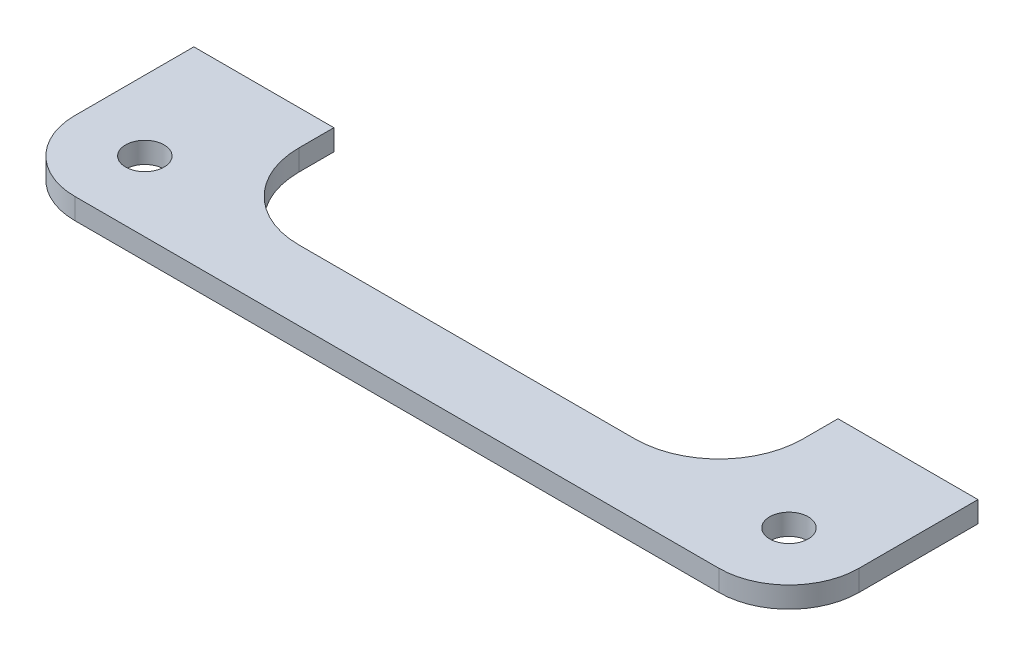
SolidWorks part; units mm, degrees
ref_plane "Front Plane" through (0, 0, 0) normal (0, 0, 1) x (1, 0, 0)
ref_plane "Top Plane" through (0, 0, 0) normal (0, 1, 0) x (1, 0, 0)
ref_plane "Right Plane" through (0, 0, 0) normal (1, 0, 0) x (0, 0, -1)
sketch "Sketch1" plane through (0, 0, 0) normal (0, 1, 0) x (1, 0, 0)
  line L0 (10, 0) -> (102, 0)
  line L1 (112, 10) -> (112, 27)
  line L2 (112, 27) -> (92, 27)
  line L3 (92, 27) -> (92, 22)
  line L4 (80, 10) -> (32, 10)
  line L5 (20, 22) -> (20, 27)
  line L6 (20, 27) -> (0, 27)
  line L7 (0, 27) -> (0, 10)
  arc A0 (102, 0) -> (112, 10) centre (102, 10) ccw
  arc A1 (10, 0) -> (0, 10) centre (10, 10) cw
  arc A2 (32, 10) -> (20, 22) centre (32, 22) cw
  arc A3 (80, 10) -> (92, 22) centre (80, 22) ccw
  circle A4 centre (10, 10) radius 2.75
  circle A5 centre (102, 10) radius 2.75
  point P11 (112, 0)
  point P14 (0, 0)
  dimension "D7" = 10
  dimension "D8" = 12
  dimension "D9" = 5.5
  dimension "D10" = 5.5
  dimension "D1" = 112
  dimension "D2" = 20
  dimension "D3" = 20
  dimension "D4" = 10
  dimension "D5" = 27
  dimension "D6" = 27
extrude "Extrude1" add sketch "Sketch1" along normal blind 3
